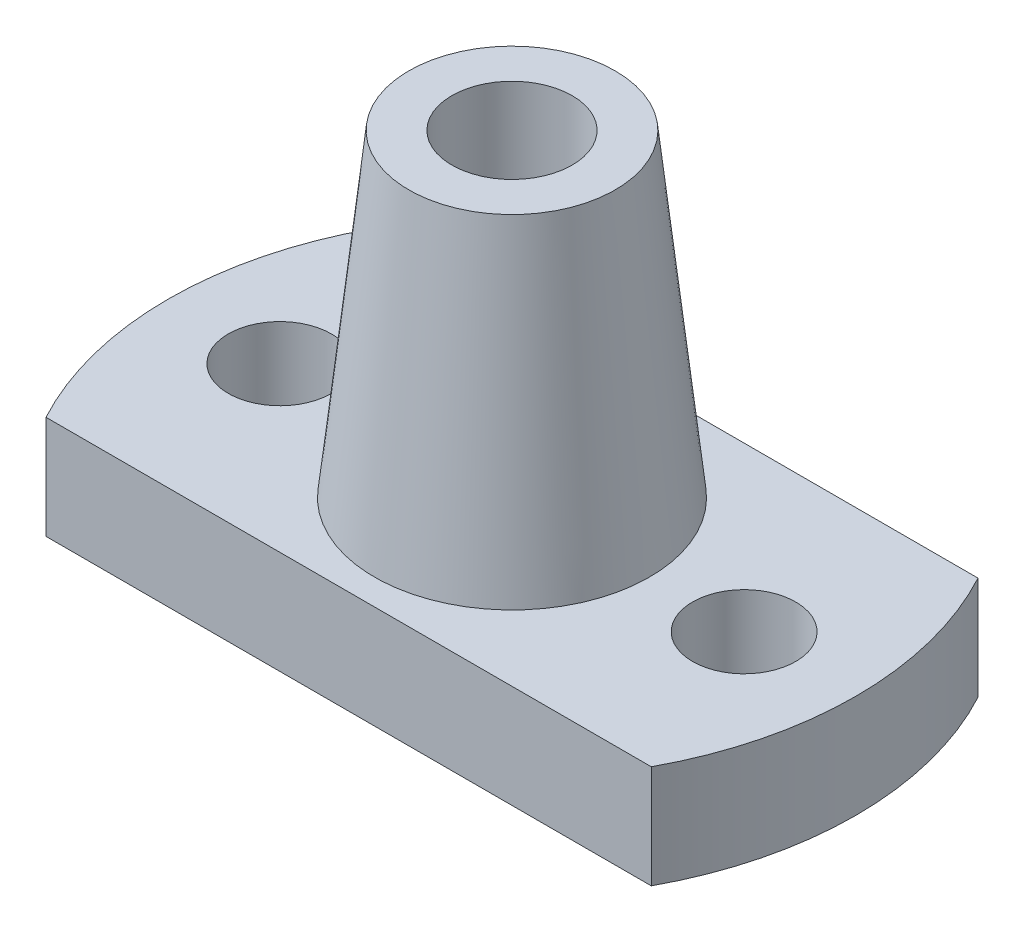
SolidWorks part; units mm, degrees
ref_plane "前视基准面" through (0, 0, 0) normal (0, 0, 1) x (1, 0, 0)
ref_plane "上视基准面" through (0, 0, 0) normal (0, 1, 0) x (1, 0, 0)
ref_plane "右视基准面" through (0, 0, 0) normal (1, 0, 0) x (0, 0, -1)
sketch "草图1" plane through (0, 0, 0) normal (0, 0, 1) x (1, 0, 0)
  line L0 (0, 0) -> (0, 117.2195) construction
  line L1 (7, 0) -> (40, 0)
  line L2 (40, 0) -> (40, 12)
  line L3 (40, 12) -> (16, 12)
  line L4 (16, 12) -> (12, 49)
  line L5 (12, 49) -> (7, 49)
  line L6 (7, 49) -> (7, 0)
  dimension "D1" = 40
  dimension "D2" = 12
  dimension "D3" = 16
  dimension "D4" = 7
  dimension "D5" = 49
  dimension "D6" = 12
revolve "旋转1" add sketch "草图1" angle 360 about L0
sketch "草图2" plane through (0, 12, 0) normal (0, 1, 0) x (1, 0, 0)
  line L0 (0, 0) -> (51.2358, 0) construction
  line L1 (-50.2442, 45.1206) -> (46.6081, 45.1206)
  line L2 (-50.2442, 45.1206) -> (-50.2442, 19)
  line L3 (-50.2442, 19) -> (46.6081, 19)
  line L4 (46.6081, 45.1206) -> (46.6081, 19)
  line L5 (-50.2442, -45.1206) -> (-50.2442, -19)
  line L6 (46.6081, -45.1206) -> (46.6081, -19)
  line L7 (-50.2442, -19) -> (46.6081, -19)
  line L8 (-50.2442, -45.1206) -> (46.6081, -45.1206)
  line L9 (0, 0) -> (0, 45.1206) construction
  circle A0 centre (27, 0) radius 6
  circle A1 centre (-27, 0) radius 6
  dimension "D2" = 27
  dimension "D1" = 19
extrude "切除-拉伸1" cut sketch "草图2" against normal through all
